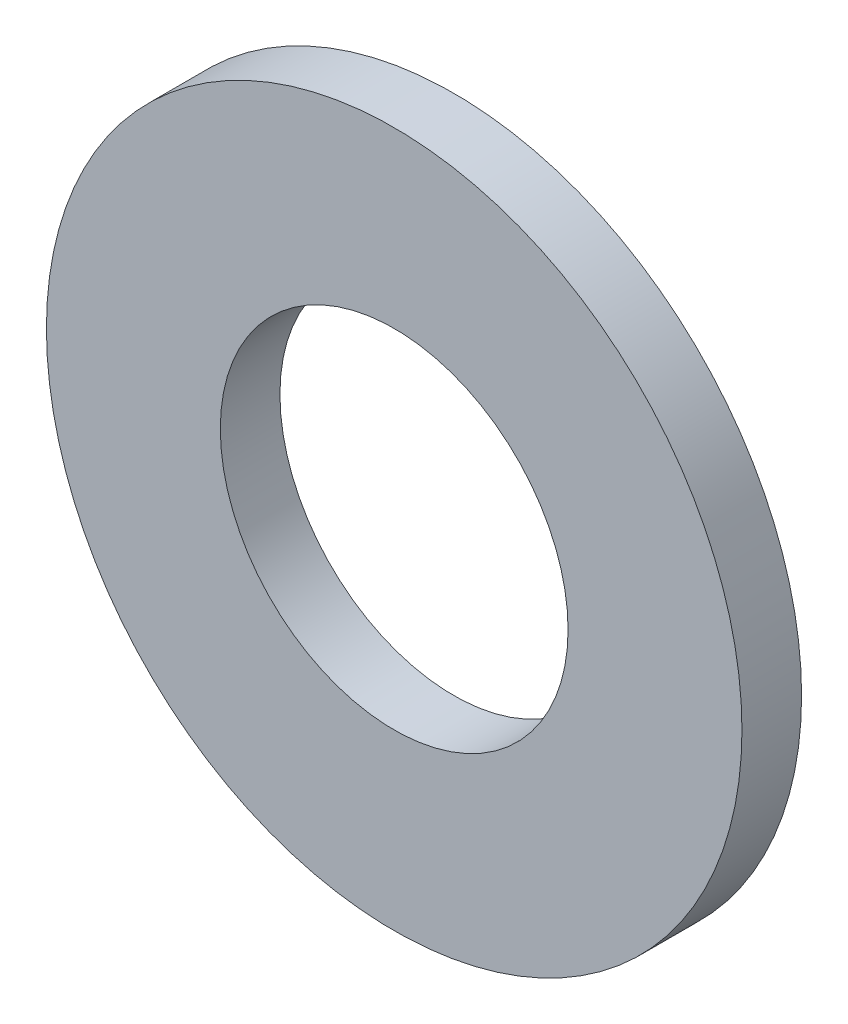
SolidWorks part; units mm, degrees
ref_plane "Plan de face" through (0, 0, 0) normal (0, 0, 1) x (1, 0, 0)
ref_plane "Plan de dessus" through (0, 0, 0) normal (0, 1, 0) x (1, 0, 0)
ref_plane "Plan de droite" through (0, 0, 0) normal (1, 0, 0) x (0, 0, -1)
sketch "Esquisse1" plane through (0, 0, 0) normal (0, 1, 0) x (1, 0, 0)
  line L0 (3.5, -1.2) -> (7, -1.2)
  line L1 (7, -1.2) -> (7, 0)
  line L2 (7, 0) -> (3.5, 0)
  line L3 (3.5, 0) -> (3.5, -1.2)
  line L4 (0, 0) -> (0, -1.2) construction
revolve "Révolution1" add sketch "Esquisse1" angle 360 about L4
